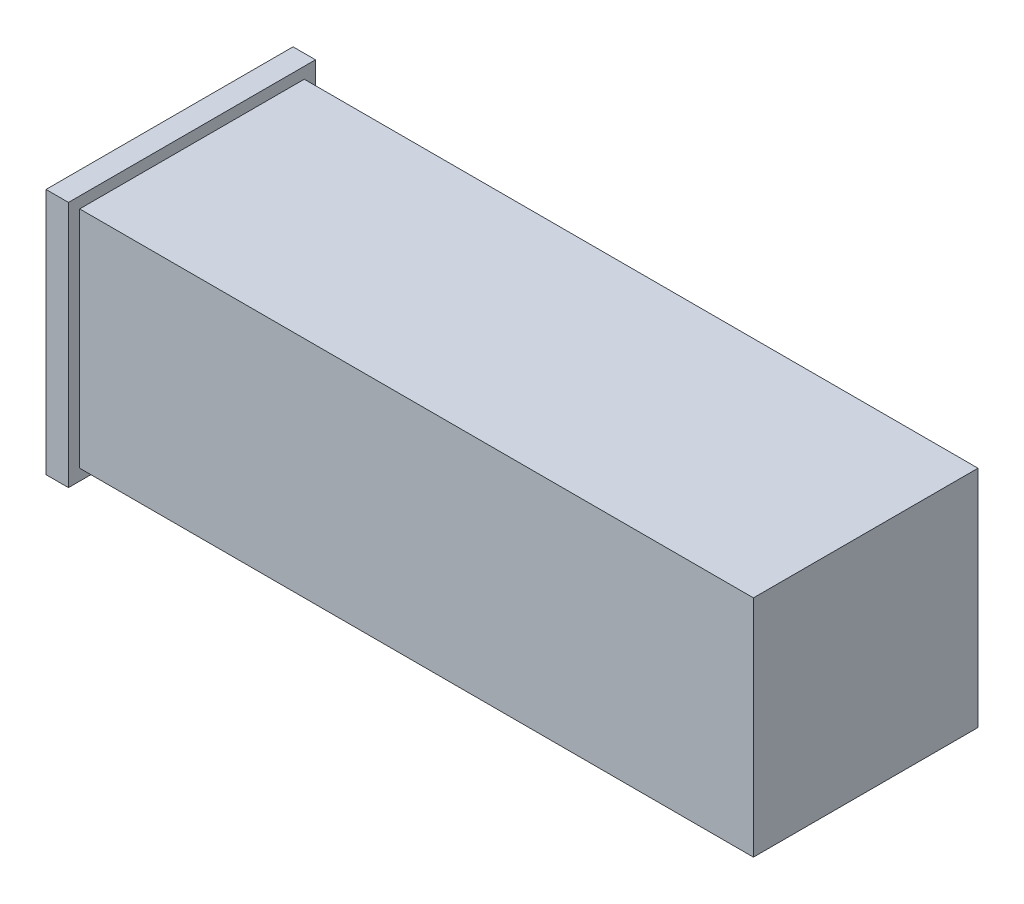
SolidWorks part; units mm, degrees
ref_plane "Front Plane" through (0, 0, 0) normal (0, 0, 1) x (1, 0, 0)
ref_plane "Top Plane" through (0, 0, 0) normal (0, 1, 0) x (1, 0, 0)
ref_plane "Right Plane" through (0, 0, 0) normal (1, 0, 0) x (0, 0, -1)
sketch "Sketch1" plane through (0, 0, 0) normal (0, 0, 1) x (1, 0, 0)
  line L1 (0, -10.9966) -> (300, -10.9966)
  line L2 (0, -10.9966) -> (0, 89.0034)
  line L3 (0, 89.0034) -> (300, 89.0034)
  line L4 (300, -10.9966) -> (300, 89.0034)
  dimension "D1" = 300
  dimension "D2" = 100
extrude "Boss-Extrude1" add sketch "Sketch1" along normal blind 100
sketch "Sketch2" plane through (0, 0, 0) normal (-1, 0, 0) x (0, 0, 1)
  line L5 (100, 89.0034) -> (100, -10.9966) construction
  line L6 (-5, -15.9966) -> (105, -15.9966)
  line L7 (-5, -15.9966) -> (-5, 94.0034)
  line L8 (-5, 94.0034) -> (105, 94.0034)
  line L9 (105, -15.9966) -> (105, 94.0034)
  line L10 (-5, -15.9966) -> (105, 94.0034) construction
  line L11 (-5, 94.0034) -> (105, -15.9966) construction
  line L12 (100, 89.0034) -> (0, 89.0034) construction
  point P0 (50, 39.0034)
  point P7 (100, 39.0034)
  point P8 (105, 39.0034)
  point P11 (50, 89.0034)
  point P12 (50, 94.0034)
  dimension "D1" = 110
  dimension "D2" = 110
extrude "Boss-Extrude2" add sketch "Sketch2" along normal blind 10
